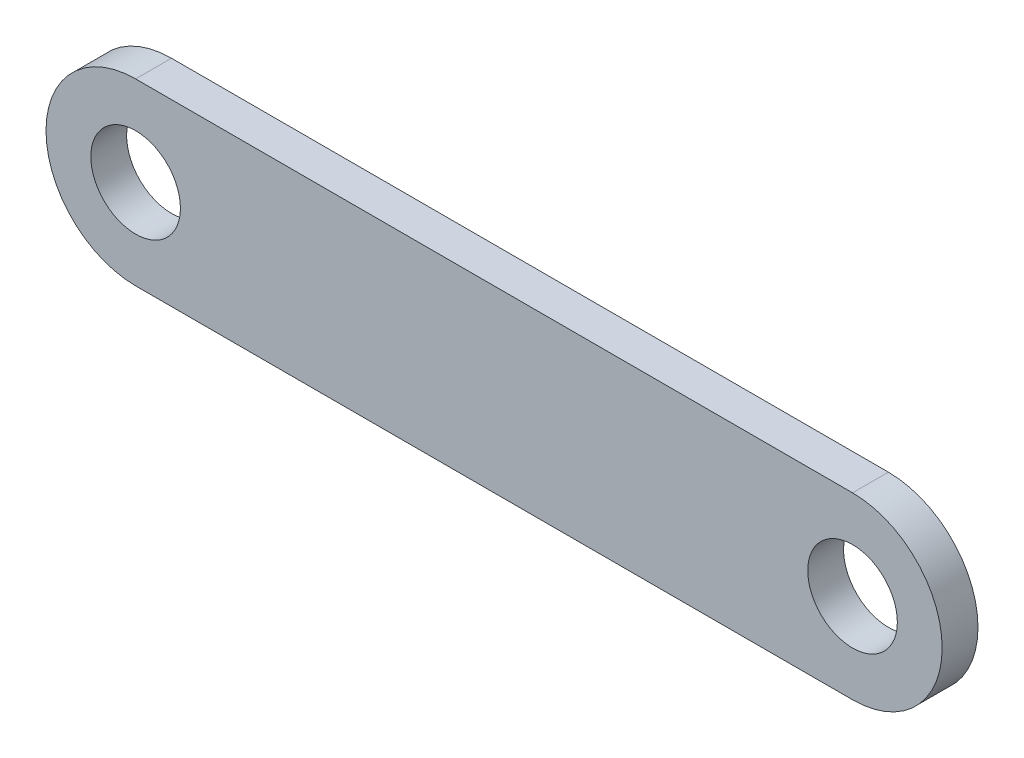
SolidWorks part; units mm, degrees
ref_plane "Front Plane" through (0, 0, 0) normal (0, 0, 1) x (1, 0, 0)
ref_plane "Top Plane" through (0, 0, 0) normal (0, 1, 0) x (1, 0, 0)
ref_plane "Right Plane" through (0, 0, 0) normal (1, 0, 0) x (0, 0, -1)
sketch "Sketch1" plane through (0, 0, 0) normal (0, 0, 1) x (1, 0, 0)
  line L0 (-20, 0) -> (20, 0) construction
  line L1 (-20, 5) -> (20, 5)
  line L2 (-20, -5) -> (20, -5)
  arc A0 (-20, 5) -> (-20, -5) centre (-20, 0) ccw
  arc A1 (20, -5) -> (20, 5) centre (20, 0) ccw
  circle A2 centre (-20, 0) radius 2.5
  circle A3 centre (20, 0) radius 2.5
  point P2 (0, 0)
  dimension "D3" = 5
  dimension "D4" = 5
  dimension "D1" = 40
  dimension "D2" = 10
extrude "Boss-Extrude1" add sketch "Sketch1" along normal mid plane 2
